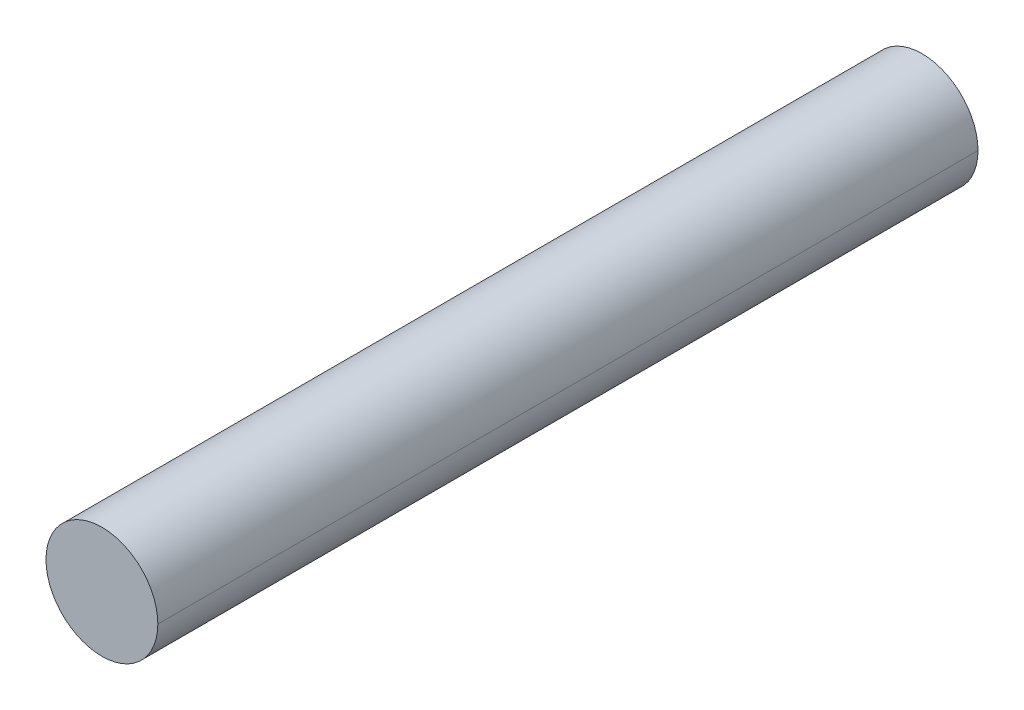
SolidWorks part; units mm, degrees
ref_plane "Front Plane" through (0, 0, 0) normal (0, 0, 1) x (1, 0, 0)
ref_plane "Top Plane" through (0, 0, 0) normal (0, 1, 0) x (1, 0, 0)
ref_plane "Right Plane" through (0, 0, 0) normal (1, 0, 0) x (0, 0, -1)
imported_body "Imported1"
sketch "Sketch1" plane through (0, 0, 152.4) normal (0, 0, 1) x (1, 0, 0)
  circle A0 centre (0, 0) radius 19.05
extrude "Cut-Extrude1" cut sketch "Sketch1" against normal blind 25.4
